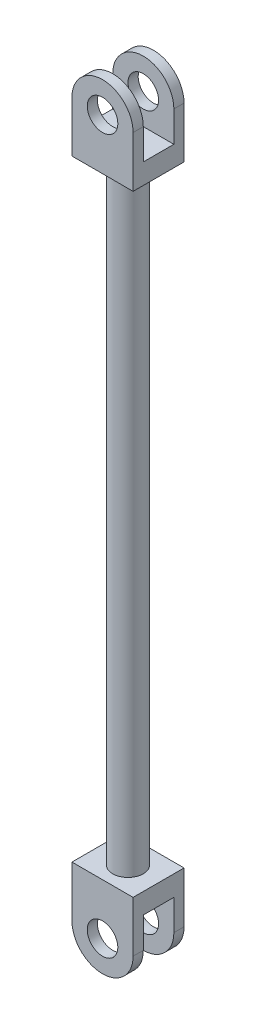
SolidWorks part; units mm, degrees
other "Markierung1"
sketch "Skizze6" plane through (3, -65, -4) normal (0.5332, -0.1002, -0.8401) x (-0.7553, -0.5038, -0.4193)
ref_plane "Ebene vorne" through (0, 0, 0) normal (0, 0, 1) x (1, 0, 0)
ref_plane "Ebene oben" through (0, 0, 0) normal (0, 1, 0) x (1, 0, 0)
ref_plane "Ebene rechts" through (0, 0, 0) normal (1, 0, 0) x (0, 0, -1)
sketch "Skizze1" plane through (0, 0, 0) normal (0, 0, 1) x (1, 0, 0)
  line L0 (-3, 0) -> (-3, -5)
  line L1 (-3, -5) -> (3, -5)
  line L2 (3, -5) -> (3, 0)
  arc A0 (3, 0) -> (-3, 0) centre (0, 0) ccw
  dimension "D1" = 6
  dimension "D2" = 5
extrude "Aufsatz-Linear austragen1" add sketch "Skizze1" along normal blind 1
sketch "Skizze2" plane through (0, 0, 0) normal (0, 0, -1) x (-1, 0, 0)
  line L0 (3, 0) -> (3, -5) construction
  line L1 (-3, -5) -> (3, -5)
  line L2 (-3, -5) -> (-3, -3)
  line L3 (-3, -3) -> (3, -3)
  line L4 (3, -5) -> (3, -3)
  circle A0 centre (0, 0) radius 1.5
  dimension "D1" = 3
  dimension "D2" = 2
extrude "Aufsatz-Linear austragen3" add sketch "Skizze2" along normal blind 3 contours L3 M2 M3 M4 | A0
sketch "Skizze3" plane through (0, 0, -3) normal (0, 0, -1) x (-1, 0, 0)
  line L0 (-3, 0) -> (-3, -5)
  line L1 (-3, -5) -> (3, -5)
  line L2 (3, -5) -> (3, 0)
  arc A0 (3, 0) -> (-3, 0) centre (0, 0) ccw
extrude "Aufsatz-Linear austragen4" add sketch "Skizze3" along normal blind 1
sketch "Skizze5" plane through (0, -5, 0) normal (0, -1, 0) x (1, 0, 0)
  line L0 (-3, 1) -> (3, -4) construction
  circle A0 centre (0, -1.5) radius 1.5
  dimension "D1" = 3
extrude "Aufsatz-Linear austragen5" add sketch "Skizze5" along normal blind 60
sketch "Skizze7" plane through (0, -65, 0) normal (0, -1, 0) x (1, 0, 0)
  line L1 (-3, 1) -> (3, 1)
  line L2 (-3, 1) -> (-3, -4)
  line L3 (-3, -4) -> (3, -4)
  line L4 (3, 1) -> (3, -4)
extrude "Aufsatz-Linear austragen6" add sketch "Skizze7" along normal blind 8
sketch "Skizze9" plane through (0, -73, 0) normal (0, -1, 0) x (1, 0, 0)
  line L0 (-3, 1) -> (3, -4) construction
  line L1 (3, -4) -> (3, 1) construction
  line L2 (-3, -3) -> (3, -3)
  line L3 (-3, -3) -> (-3, 0)
  line L4 (-3, 0) -> (3, 0)
  line L5 (3, -3) -> (3, 0)
  line L6 (-3, -3) -> (3, 0) construction
  line L7 (-3, 0) -> (3, -3) construction
  line L8 (3, 1) -> (-3, 1) construction
  point P4 (0, -1.5)
  dimension "D1" = 1
extrude "Schnitt-Linear austragen1" cut sketch "Skizze9" against normal blind 6
fillet "Verrundung2" radius 3 4 edges at (3, -73, -3.5) (3, -73, 0.5) (-3, -73, -3.5) (-3, -73, 0.5)
sketch "Skizze10" plane through (0, 0, 1) normal (0, 0, 1) x (1, 0, 0)
  circle A0 centre (0, -70) radius 1.5
  circle A1 centre (0, 0) radius 1.5
  dimension "D1" = 3
  dimension "D2" = 3
extrude "Schnitt-Linear austragen2" cut sketch "Skizze10" against normal blind 6
